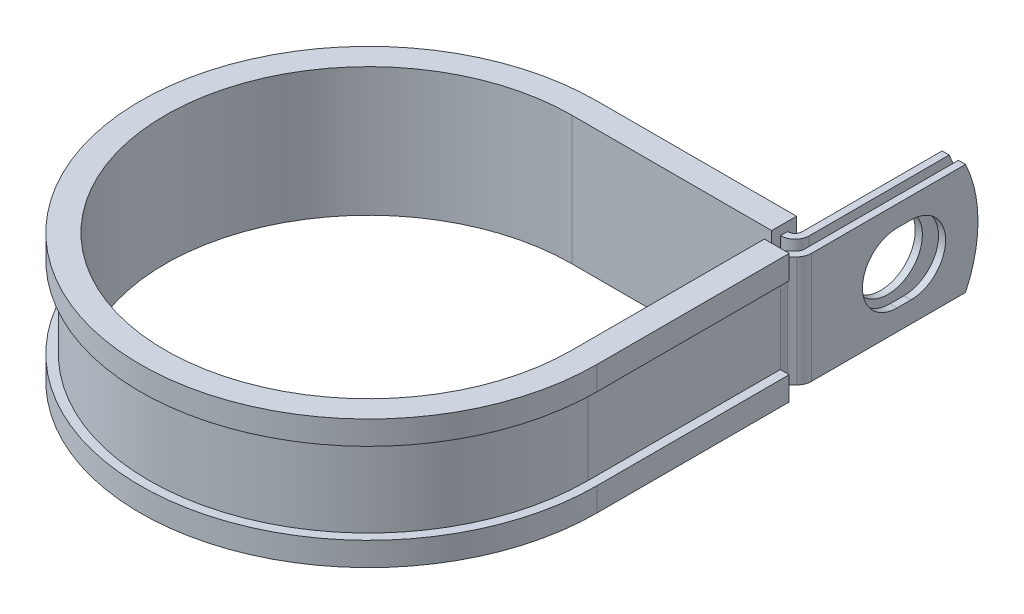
SolidWorks part; units mm, degrees
ref_plane "Front Plane" through (0, 0, 0) normal (0, 0, 1) x (1, 0, 0)
ref_plane "Top Plane" through (0, 0, 0) normal (0, 1, 0) x (1, 0, 0)
ref_plane "Right Plane" through (0, 0, 0) normal (1, 0, 0) x (0, 0, -1)
sketch "Sketch1" plane through (0, 0, 0) normal (0, 1, 0) x (1, 0, 0)
  line L0 (0, 36.449) -> (34.3333, 36.449)
  line L1 (36.449, 0) -> (36.449, 33.0365)
  line L2 (36.7717, 65.0748) -> (36.7717, 38.8874)
  line L3 (37.1632, 34.7607) -> (37.9894, 35.5869)
  line L5 (38.3465, 36.449) -> (38.3465, 65.0748)
  arc A0 (0, 36.449) -> (36.449, 0) centre (0, 0) ccw
  arc A1 (37.1632, 34.7607) -> (36.449, 33.0365) centre (38.8874, 33.0365) ccw
  arc A2 (37.9894, 35.5869) -> (38.3465, 36.449) centre (37.1273, 36.449) ccw
  arc A3 (34.3333, 36.449) -> (36.7717, 38.8874) centre (34.3333, 38.8874) ccw
extrude "Extrude-Thin1" add sketch "Sketch1" along normal mid plane 19.05 thin
sketch "Sketch2" plane through (35.5525, 0, 0) normal (-1, 0, 0) x (0, 0, 1)
  line L0 (-65.0748, 9.525) -> (-65.0748, -9.525) construction
  line L1 (0, 9.525) -> (0, -9.525) construction
  circle A0 centre (-52.3748, 0) radius 5.9436
  point P2 (-65.0748, 0)
extrude "Cut-Extrude1" cut sketch "Sketch2" against normal up to surface (1.2192 mm away)
sketch "Sketch3" plane through (39.5657, 0, 0) normal (1, 0, 0) x (0, 0, -1)
  line L0 (51.181, 0) -> (53.5686, 0) construction
  line L1 (51.181, 5.9436) -> (53.5686, 5.9436)
  line L2 (51.181, -5.9436) -> (53.5686, -5.9436)
  line L3 (65.0748, 9.525) -> (65.0748, -9.525) construction
  arc A0 (51.181, 5.9436) -> (51.181, -5.9436) centre (51.181, 0) ccw
  arc A1 (53.5686, -5.9436) -> (53.5686, 5.9436) centre (53.5686, 0) ccw
  point P3 (52.3748, 0)
  point P8 (65.0748, 0)
  point P11 (45.2374, 0)
  point P12 (59.5122, 0)
extrude "Cut-Extrude2" cut sketch "Sketch3" against normal up to surface (1.2192 mm away)
sketch "Sketch4" plane through (35.5525, 0, 0) normal (-1, 0, 0) x (0, 0, 1)
  line L0 (-65.0748, 9.525) -> (-65.0748, -9.525)
  line L1 (-65.0748, 9.525) -> (-62.9303, 9.525)
  line L2 (-65.0748, 9.525) -> (-38.8874, 9.525) construction
  line L3 (-65.0748, -9.525) -> (-62.9303, -9.525)
  line L4 (-65.0748, -9.525) -> (-38.8874, -9.525) construction
  arc A0 (-62.9303, 9.525) -> (-62.9303, -9.525) centre (-42.8498, 0) ccw
extrude "Cut-Extrude3" cut sketch "Sketch4" against normal through all contours A0 M4 M5 | A0 L0 M2
ref_plane "Plane1" through (0, 0, -33.0365) normal (0, 0, -1) x (-1, 0, 0)
ref_plane "Plane2" through (34.2825, 0, 0) normal (-1, 0, 0) x (0, 0, 1)
sketch "Sketch5" plane through (0, 0, -33.0365) normal (0, 0, -1) x (-1, 0, 0)
  line L0 (-37.6682, 9.525) -> (-36.449, 9.525)
  line L1 (-37.6682, 9.525) -> (-37.6682, -9.525) construction
  line L3 (-36.449, 9.525) -> (-36.449, -9.525)
  line L4 (-36.449, -9.525) -> (-37.6682, -9.525)
  line L5 (-37.6682, -9.525) -> (-37.6682, -6.985)
  line L6 (-37.6682, 9.525) -> (-37.6682, 6.985)
  line L7 (-39.1922, 11.049) -> (-39.1922, 6.985)
  line L8 (-39.1922, 11.049) -> (-34.925, 11.049)
  line L9 (-34.925, 11.049) -> (-34.925, -11.049)
  line L10 (-34.925, -11.049) -> (-39.1922, -11.049)
  line L11 (-39.1922, -11.049) -> (-39.1922, -6.985)
  line L12 (-39.1922, 6.985) -> (-37.6682, 6.985)
  line L13 (-37.6682, -6.985) -> (-39.1922, -6.985)
sketch "Sketch6" plane through (0, 9.525, 0) normal (0, 1, 0) x (1, 0, 0)
  line L0 (34.925, 0) -> (34.925, 33.0365)
  line L1 (34.925, 33.0365) -> (39.1922, 33.0365) construction
  line L2 (34.2825, 6.9878) -> (34.2825, -6.9878) construction
  line L5 (0, 34.925) -> (34.2825, 34.925)
  arc A0 (0, 34.925) -> (34.925, 0) centre (0, 0) ccw
sweep "Sweep1" add profiles "Sketch5" path "Sketch6"
equation "\"D4@Sketch5\" = \"D1@Extrude-Thin1\""
equation "\"D5@Sketch5\" = \"D5@Extrude-Thin1\""
equation "\"D1@Sketch3\" = \"D2@Sketch2\""
equation "\"D7@Sketch1\" = \"D3@Sketch2\" + \"D1@Sketch3\""
equation "\"D1@Sketch1\" = \"D1@Sketch6\" + 2 * \"D3@Sketch5\""
equation "\"D1@Sketch4\" = ( \"D1@Extrude-Thin1\" + .125 ) * 2"
equation "\"D9@Sketch1\"= \"D5@Extrude-Thin1\""
equation "\"D8@Sketch1\"= 2 * \"D5@Extrude-Thin1\""
equation "\"D2@Sketch1\" = 2 * \"D5@Extrude-Thin1\""
equation "\"D2@Sketch3\" = \"D1@Sketch2\""
